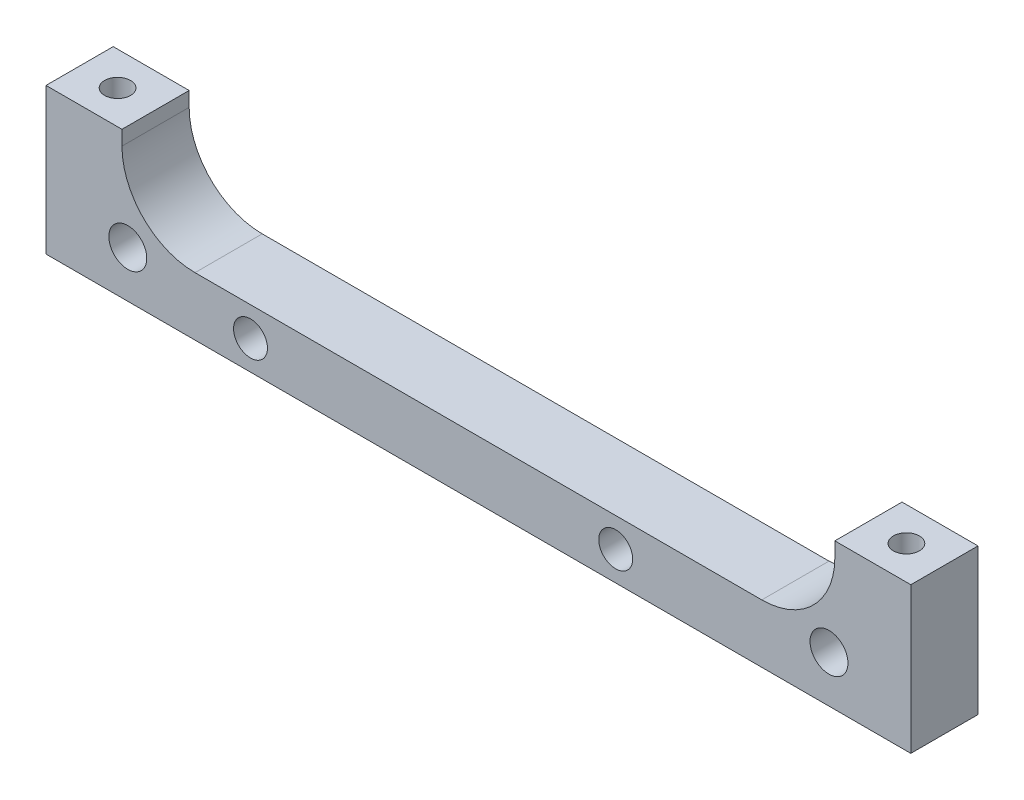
SolidWorks part; units mm, degrees
ref_plane "Front" through (0, 0, 0) normal (0, 0, 1) x (1, 0, 0)
ref_plane "Top" through (0, 0, 0) normal (0, 1, 0) x (1, 0, 0)
ref_plane "Right" through (0, 0, 0) normal (1, 0, 0) x (0, 0, -1)
sketch "Sketch1" plane through (0, 0, 0) normal (0, 0, 1) x (1, 0, 0)
  line L1 (0, 0) -> (75.184, 0)
  line L2 (0, 0) -> (0, -12.7)
  line L3 (0, -12.7) -> (75.184, -12.7)
  line L4 (75.184, 0) -> (75.184, -12.7)
  dimension "D1" = 75.184
  dimension "D2" = 12.7
extrude "Extrude1" add sketch "Sketch1" along normal blind 5.842
sketch "Sketch2" plane through (0, 0, 5.842) normal (0, 0, 1) x (1, 0, 0)
  line L0 (75.184, 0) -> (0, 0) construction
  line L1 (6.604, 0) -> (68.58, 0)
  line L2 (6.604, 0) -> (6.604, -7.62)
  line L3 (6.604, -7.62) -> (68.58, -7.62)
  line L4 (68.58, 0) -> (68.58, -7.62)
  line L5 (0, 0) -> (0, -12.7) construction
  line L6 (75.184, -12.7) -> (75.184, 0) construction
  dimension "D1" = 6.604
  dimension "D2" = 6.604
  dimension "D3" = 7.62
extrude "Cut-Extrude1" cut sketch "Sketch2" against normal through all
chamfer "Chamfer1" [suppressed] distance 8.89 angle 45
chamfer "Chamfer2" [suppressed] distance 8.89 angle 45
hole_wizard "#4-40 Tapped Hole1" positions "Sketch4" profile "Sketch3" tap size "#4-40" standard "Ansi Inch"
sketch "Sketch4" plane through (0, 0, 0) normal (0, 1, 0) x (-1, 0, 0)
  line L0 (-3.302, 5.842) -> (-3.302, 0) construction
  line L1 (-6.604, 5.842) -> (0, 5.842) construction
  line L2 (-6.604, 0) -> (0, 0) construction
  point P0 (-3.302, 2.921)
  point P1 (-71.882, 2.921)
  dimension "D1" = 3.302
  dimension "D2" = 68.58
sketch "Sketch3" plane through (3.302, 0, 2.921) normal (1, 0, 0) x (0, 0, 1)
  line L0 (0, 0) -> (0, 12.7)
  line L1 (0, 12.7) -> (1.1303, 12.7)
  line L2 (1.1303, 12.7) -> (1.1303, 0)
  line L5 (1.1303, 0) -> (0, 0)
  line L11 (0, -6.35) -> (0, 107.95) construction
  dimension "Thru Tap Drill Dia." = 2.2606
  dimension "Thru Tap Drill Depth" = 12.7
fillet "Fillet1" radius 6.35 2 edges at (6.604, -7.62, 2.921) (68.58, -7.62, 2.921)
hole_wizard "#32 (0.116) Diameter Hole1" positions "Sketch6" profile "Sketch5" hole size "#32" standard "Ansi Inch"
sketch "Sketch6" plane through (-32.127, 0.7043, 0) normal (0, 0, 1) x (1, 0, 0)
  line L0 (32.127, -15.9443) -> (107.311, -15.9443) construction
  line L1 (107.311, -15.9443) -> (107.311, -0.7043) construction
  line L2 (32.127, -0.7043) -> (32.127, -15.9443) construction
  point P0 (99.183, -12.3883)
  point P1 (40.255, -12.3883)
  dimension "D1" = 3.556
  dimension "D2" = 8.128
  dimension "D3" = 8.128
sketch "Sketch5" plane through (67.056, -11.684, 0) normal (1, 0, 0) x (0, 1, 0)
  line L0 (0, 0) -> (0, 5.842)
  line L1 (0, 5.842) -> (1.4732, 5.842)
  line L2 (1.4732, 5.842) -> (1.4732, 0)
  line L5 (1.4732, 0) -> (0, 0)
  line L11 (0, -6.35) -> (0, 107.95) construction
  dimension "Thru Hole Dia." = 2.9464
  dimension "Thru Hole Depth" = 5.842
hole_wizard "#4-40 Tapped Hole2" positions "Sketch8" profile "Sketch7" tap size "#4-40" standard "Ansi Inch"
sketch "Sketch8" plane through (75.184, 0, 0) normal (1, 0, 0) x (0, 0, -1)
  line L0 (-5.842, -12.7) -> (0, -6.858) construction
  line L1 (0, -12.7) -> (0, 0) construction
  line L2 (-5.842, -12.7) -> (0, -12.7) construction
  point P0 (-2.921, -9.779)
  dimension "D1" = 45
sketch "Sketch7" plane through (75.184, -9.779, 2.921) normal (0, 1, 0) x (0, 0, -1)
  line L0 (0, 0) -> (0, 9.1882)
  line L1 (0, 9.1882) -> (1.1303, 8.509)
  line L2 (1.1303, 8.509) -> (1.1303, 0)
  line L5 (1.1303, 0) -> (0, 0)
  line L10 (0, 9.1882) -> (-1.1303, 8.509) construction
  line L11 (0, -6.35) -> (0, 107.95) construction
  dimension "Tap Drill Dia." = 2.2606
  dimension "Tap Drill Depth" = 8.509
  dimension "Drill Angle" = 118
hole_wizard "#4-40 Tapped Hole3" positions "Sketch10" profile "Sketch9" tap size "#4-40" standard "Ansi Inch"
sketch "Sketch10" plane through (0, 0, 0) normal (0, 1, 0) x (-1, 0, 0)
  line L0 (0, 5.842) -> (0, 0) construction
  line L1 (-3.302, 5.842) -> (-3.302, 0) construction
  line L2 (-6.604, 5.842) -> (0, 5.842) construction
  line L3 (-6.604, 0) -> (0, 0) construction
  point P0 (-3.302, 2.921)
  point P1 (-71.882, 2.921)
  point P4 (0, 2.921)
  point P14 (-3.302, 2.921)
  dimension "D1" = 3.302
  dimension "D2" = 68.58
sketch "Sketch9" plane through (3.302, 0, 2.921) normal (1, 0, 0) x (0, 0, 1)
  line L0 (0, 0) -> (0, 9.1882)
  line L1 (0, 9.1882) -> (1.1303, 8.509)
  line L2 (1.1303, 8.509) -> (1.1303, 0)
  line L5 (1.1303, 0) -> (0, 0)
  line L10 (0, 9.1882) -> (-1.1303, 8.509) construction
  line L11 (0, -6.35) -> (0, 107.95) construction
  dimension "Tap Drill Dia." = 2.2606
  dimension "Tap Drill Depth" = 8.509
  dimension "Drill Angle" = 118
hole_wizard "M3.1 (3.1) Diameter Hole1" positions "Sketch12" profile "Sketch11" hole size "M3.1" standard "Ansi Metric"
sketch "Sketch12" plane through (0, 0, 0) normal (0, 0, -1) x (-1, 0, 0)
  line L0 (0, 0) -> (0, -12.7) construction
  line L1 (-75.184, -12.7) -> (-75.184, 0) construction
  line L2 (0, -12.7) -> (-75.184, -12.7) construction
  point P0 (-7.366, -9.525)
  point P1 (-67.818, -9.525)
  dimension "D1" = 7.366
  dimension "D2" = 7.366
  dimension "D3" = 3.175
sketch "Sketch11" plane through (7.366, -9.525, 0) normal (1, 0, 0) x (0, 1, 0)
  line L0 (0, 0) -> (0, 5.842)
  line L1 (0, 5.842) -> (1.55, 5.842)
  line L2 (1.55, 5.842) -> (1.55, 0)
  line L5 (1.55, 0) -> (0, 0)
  line L11 (0, -6.35) -> (0, 107.95) construction
  dimension "Thru Hole Dia." = 3.1
  dimension "Thru Hole Depth" = 5.842
hole_wizard "#32 (0.116) Diameter Hole2" positions "Sketch14" profile "Sketch13" hole size "#32" standard "Ansi Inch"
sketch "Sketch14" plane through (0, 0, 0) normal (0, 0, -1) x (-1, 0, 0)
  line L0 (-49.53, -7.62) -> (-49.53, -12.7) construction
  line L1 (-12.954, -7.62) -> (-62.23, -7.62) construction
  line L2 (0, -12.7) -> (-75.184, -12.7) construction
  line L4 (0, 0) -> (0, -12.7) construction
  point P0 (-49.53, -10.16)
  point P1 (-17.78, -10.16)
  dimension "D1" = 31.75
  dimension "D2" = 17.78
sketch "Sketch13" plane through (49.53, -10.16, 0) normal (1, 0, 0) x (0, 1, 0)
  line L0 (0, 0) -> (0, 5.842)
  line L1 (0, 5.842) -> (1.4732, 5.842)
  line L2 (1.4732, 5.842) -> (1.4732, 0)
  line L5 (1.4732, 0) -> (0, 0)
  line L11 (0, -6.35) -> (0, 107.95) construction
  dimension "Thru Hole Dia." = 2.9464
  dimension "Thru Hole Depth" = 5.842
hole_wizard "M4.1 (4.1) Diameter Hole1" positions "3DSketch1" profile "Sketch17" hole size "M4.1" standard "Ansi Metric"
sketch3d "3DSketch1"
  line L2 (0, -12.7, 5.842) -> (75.184, -12.7, 5.842) construction
  line L3 (75.184, -12.7, 0) -> (75.184, 0, 0) construction
  line L5 (0, 0, 0) -> (0, -12.7, 0) construction
  point P0 (7.112, -8.6439, 0)
  point P31 (68.072, -8.6439, 0)
  dimension "D1" = 7.112
  dimension "D2" = 7.112
  dimension "D3" = 7.112
sketch "Sketch17" plane through (7.112, -8.6439, 0) normal (1, 0, 0) x (0, 1, 0)
  line L0 (0, 0) -> (0, 5.842)
  line L1 (0, 5.842) -> (2.05, 5.842)
  line L2 (2.05, 5.842) -> (2.05, 0)
  line L5 (2.05, 0) -> (0, 0)
  line L11 (0, -6.35) -> (0, 107.95) construction
  dimension "Thru Hole Dia." = 4.1
  dimension "Thru Hole Depth" = 5.842
hole_wizard "M4x0.7 Tapped Hole1" positions "Sketch19" profile "Sketch18" tap size "M4x0.7" standard "Ansi Metric"
sketch "Sketch19" plane through (0, 0, 0) normal (0, 0, -1) x (-1, 0, 0)
  point P0 (-68.072, -8.6439)
  point P1 (-7.112, -8.6439)
sketch "Sketch18" plane through (68.072, -8.6439, 0) normal (1, 0, 0) x (0, 1, 0)
  line L0 (0, 0) -> (0, 5.842)
  line L1 (0, 5.842) -> (1.65, 5.842)
  line L2 (1.65, 5.842) -> (1.65, 0)
  line L5 (1.65, 0) -> (0, 0)
  line L11 (0, -6.35) -> (0, 107.95) construction
  dimension "Thru Tap Drill Dia." = 3.3
  dimension "Thru Tap Drill Depth" = 5.842
